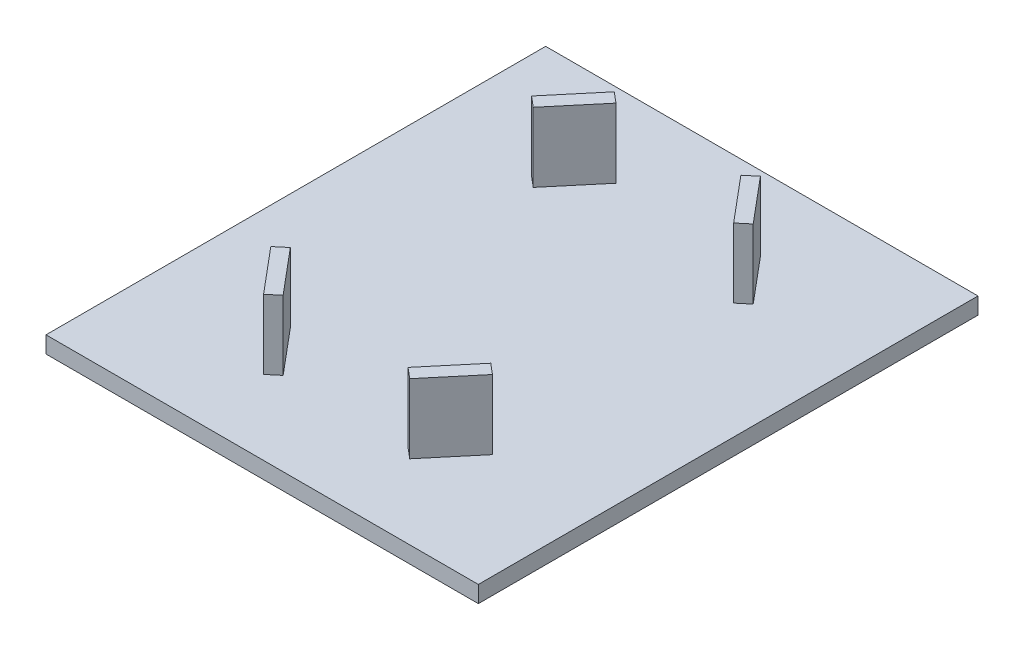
SolidWorks part; units mm, degrees
ref_plane "Front Plane" through (0, 0, 0) normal (0, 0, 1) x (1, 0, 0)
ref_plane "Top Plane" through (0, 0, 0) normal (0, 1, 0) x (1, 0, 0)
ref_plane "Right Plane" through (0, 0, 0) normal (1, 0, 0) x (0, 0, -1)
sketch "Thruster Placement Diagram" plane through (0, 0, 0) normal (0, 1, 0) x (1, 0, 0)
  line L7 (-115.75, -180) -> (115.75, -180)
  line L8 (-155.75, -140) -> (-155.75, 140)
  line L9 (-115.75, 180) -> (115.75, 180)
  line L10 (155.75, -140) -> (155.75, 140)
  line L11 (-155.75, -180) -> (155.75, 180) construction
  line L12 (-155.75, 180) -> (155.75, -180) construction
  line L17 (-90, -125) -> (90, -125) construction
  line L18 (-90, -125) -> (-90, 125) construction
  line L19 (-90, 125) -> (90, 125) construction
  line L20 (90, -125) -> (90, 125) construction
  line L21 (-90, -125) -> (90, 125) construction
  line L22 (-90, 125) -> (90, -125) construction
  line L23 (-165, -75) -> (165, -75) construction
  line L24 (-165, -75) -> (-165, 75) construction
  line L25 (-165, 75) -> (165, 75) construction
  line L26 (165, -75) -> (165, 75) construction
  line L27 (-165, -75) -> (165, 75) construction
  line L28 (-165, 75) -> (165, -75) construction
  line L34 (0, -125) -> (0, 125) construction
  line L35 (115.75, 180) -> (155.75, 180)
  line L36 (155.75, 180) -> (155.75, 140)
  line L38 (-115.75, 180) -> (-155.75, 180)
  line L39 (-155.75, 180) -> (-155.75, 140)
  line L41 (-155.75, -140) -> (-155.75, -180)
  line L42 (-155.75, -180) -> (-115.75, -180)
  line L43 (115.75, -180) -> (155.75, -180)
  line L44 (155.75, -180) -> (155.75, -140)
  circle A0 centre (-90, 125) radius 56 construction
  circle A1 centre (90, 125) radius 56 construction
  circle A2 centre (-90, -125) radius 56 construction
  circle A3 centre (90, -125) radius 56 construction
  point P0 (0, 0)
  point P32 (0, 0)
  point P39 (0, 0)
  dimension "D3" = 112
  dimension "D1" = 311.5
  dimension "D2" = 360
  dimension "D5" = 250
  dimension "D6" = 180
  dimension "D7" = 150
  dimension "D8" = 330
extrude "12mm thick" add sketch "Thruster Placement Diagram" along normal blind 12
sketch "Sketch2" plane through (0, 12, 0) normal (0, 1, 0) x (1, 0, 0)
  line L12 (-72.1899, -87.5) -> (-79.8504, -93.9279)
  line L13 (0, 0) -> (0, -196.1378) construction
  line L22 (-72.1899, 87.5) -> (-45, 119.9037)
  line L23 (-45, 119.9037) -> (-45, 87.5) construction
  line L24 (-45, 87.5) -> (-72.1899, 87.5) construction
  line L25 (-90, 0) -> (0, 0) construction
  line L26 (-90, -125) -> (-90, 125) construction
  line L27 (-39.7531, -111.7673) -> (-72.1899, -87.5) construction
  line L28 (-72.1899, -87.5) -> (-45, -119.9037) construction
  line L29 (-45, -119.9037) -> (-39.7531, -111.7673) construction
  line L30 (39.7531, -111.7673) -> (72.1899, -87.5) construction
  line L31 (72.1899, -87.5) -> (45, -119.9037) construction
  line L32 (45, -119.9037) -> (39.7531, -111.7673) construction
  line L33 (72.1899, 87.5) -> (45, 119.9037) construction
  line L34 (45, 87.5) -> (72.1899, 87.5) construction
  line L35 (45, 119.9037) -> (45, 87.5) construction
  line L36 (-72.1899, 87.5) -> (-79.8504, 93.9279)
  line L37 (-45, -87.5) -> (45, -87.5) construction
  line L38 (-45, -87.5) -> (-45, 87.5) construction
  line L39 (-45, 87.5) -> (45, 87.5) construction
  line L40 (45, -87.5) -> (45, 87.5) construction
  line L41 (-45, -87.5) -> (45, 87.5) construction
  line L42 (-45, 87.5) -> (45, -87.5) construction
  line L43 (-79.8504, 93.9279) -> (-52.6604, 126.3316)
  line L44 (-52.6604, 126.3316) -> (-45, 119.9037)
  line L45 (-79.8504, -93.9279) -> (-52.6604, -126.3316)
  line L46 (-52.6604, -126.3316) -> (-45, -119.9037)
  line L47 (-72.1899, -87.5) -> (-45, -119.9037)
  line L48 (72.1899, -87.5) -> (45, -119.9037)
  line L49 (52.6604, -126.3316) -> (45, -119.9037)
  line L50 (79.8504, -93.9279) -> (52.6604, -126.3316)
  line L51 (72.1899, -87.5) -> (79.8504, -93.9279)
  line L52 (72.1899, 87.5) -> (79.8504, 93.9279)
  line L53 (79.8504, 93.9279) -> (52.6604, 126.3316)
  line L54 (52.6604, 126.3316) -> (45, 119.9037)
  line L55 (72.1899, 87.5) -> (45, 119.9037)
  dimension "D1" = 90
  dimension "D4" = 50
  dimension "D5" = 90
  dimension "D6" = 42.3
  dimension "D7" = 10
  dimension "D8" = 175
extrude "Mounting horizontal thrusters" add sketch "Sketch2" along normal blind 50 contours L22 L44 L43 L36 | L52 L53 L54 L55 | L48 L49 L50 L51 | L12 L45 L46 L47
